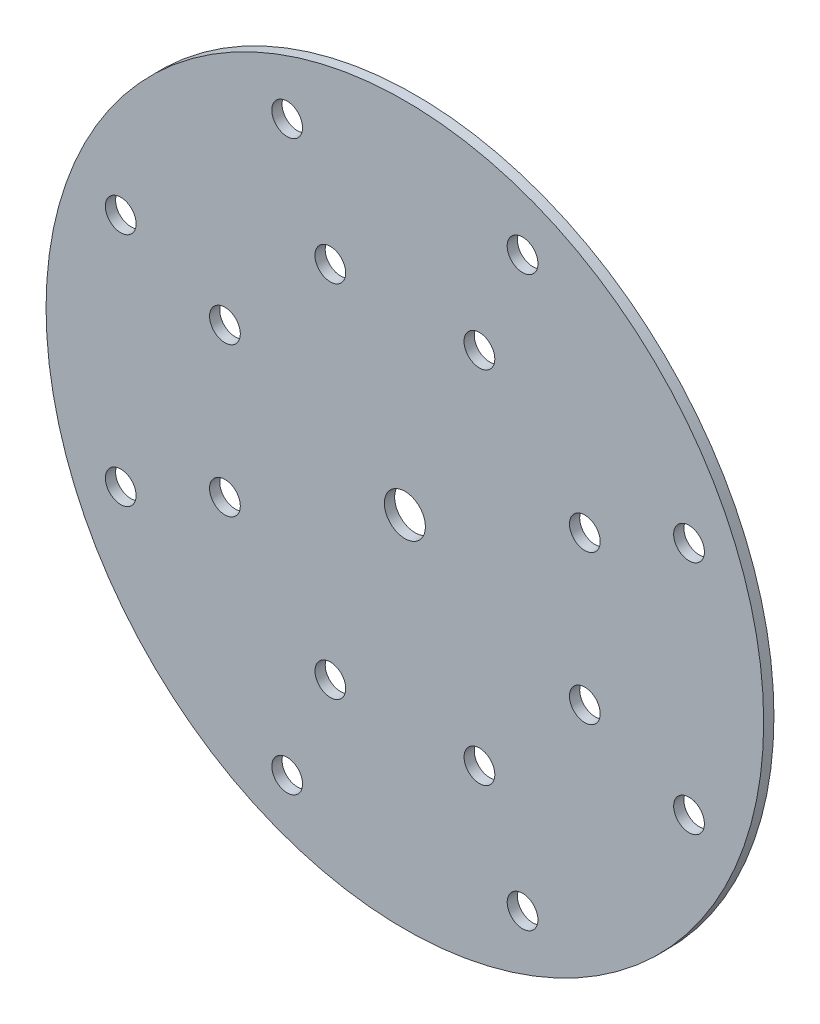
SolidWorks part; units mm, degrees
ref_plane "Front Plane" through (0, 0, 0) normal (0, 0, 1) x (1, 0, 0)
ref_plane "Top Plane" through (0, 0, 0) normal (0, 1, 0) x (1, 0, 0)
ref_plane "Right Plane" through (0, 0, 0) normal (1, 0, 0) x (0, 0, -1)
sketch "Sketch1" plane through (0, 0, 0) normal (0, 0, 1) x (1, 0, 0)
  circle A0 centre (0, 0) radius 35
extrude "Boss-Extrude1" add sketch "Sketch1" along normal blind 1
sketch "Sketch7" plane through (0, 0, 0) normal (0, 0, -1) x (-1, 0, 0)
  circle A0 centre (0, 0) radius 30
sketch "Sketch2" plane through (0, 0, 1) normal (0, 0, 1) x (1, 0, 0)
  circle A0 centre (0, 0) radius 2
extrude "Cut-Extrude1" cut sketch "Sketch2" against normal blind 1
hole_wizard "Ø3.0 (3) Diameter Hole1" positions "Sketch4" profile "Sketch3" hole size "Ø3.0" standard "Ansi Metric"
sketch "Sketch4" plane through (0, 0, 1) normal (0, 0, 1) x (1, 0, 0)
  point P9 (-11.4805, 27.7164)
  dimension "D1" = 11.4805
  dimension "D2" = 30
sketch "Sketch3" plane through (-11.4805, 27.7164, 1) normal (1, 0, 0) x (0, -1, 0)
  line L0 (0, 0) -> (0, 1.001)
  line L1 (0, 1.001) -> (1.5, 1.001)
  line L2 (1.5, 1.001) -> (1.5, 0)
  line L5 (1.5, 0) -> (0, 0)
  line L11 (0, -6.35) -> (0, 107.95) construction
  dimension "Thru Hole Dia." = 3
  dimension "Thru Hole Depth" = 1.001
pattern_circular "CirPattern1" count 8 over 360 about axis through (0, 0, 0) along (0, 0, 1) of "Ø3.0 (3) Diameter Hole1"
hole_wizard "Ø3.0 (3) Diameter Hole2" positions "Sketch6" profile "Sketch5" hole size "Ø3.0" standard "Ansi Metric"
sketch "Sketch6" plane through (0, 0, 0) normal (0, 0, -1) x (-1, 0, 0)
  point P0 (-7.27, 17.5541)
  dimension "D1" = 19
  dimension "D2" = 7.27
sketch "Sketch5" plane through (7.27, 17.5541, 0) normal (1, 0, 0) x (0, 1, 0)
  line L0 (0, 0) -> (0, 1)
  line L1 (0, 1) -> (1.5, 1)
  line L2 (1.5, 1) -> (1.5, 0)
  line L5 (1.5, 0) -> (0, 0)
  line L11 (0, -6.35) -> (0, 107.95) construction
  dimension "Thru Hole Dia." = 3
  dimension "Thru Hole Depth" = 1
pattern_circular "CirPattern2" count 8 over 360 about axis through (0, 0, 0) along (0, 0, 1) of "Ø3.0 (3) Diameter Hole2"
